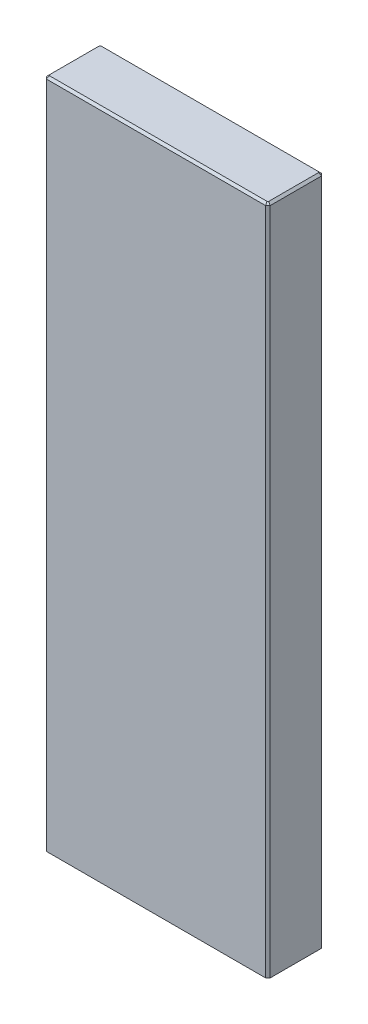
SolidWorks part; units mm, degrees
ref_plane "Front" through (0, 0, 0) normal (0, 0, 1) x (1, 0, 0)
ref_plane "Top" through (0, 0, 0) normal (0, 1, 0) x (1, 0, 0)
ref_plane "Right" through (0, 0, 0) normal (1, 0, 0) x (0, 0, -1)
sketch "Sketch1" plane through (0, 0, 0) normal (0, 0, 1) x (1, 0, 0)
  line L1 (-25.4, 152.4) -> (25.4, 152.4)
  line L2 (-25.4, 152.4) -> (-25.4, 0)
  line L3 (-25.4, 0) -> (25.4, 0)
  line L4 (25.4, 152.4) -> (25.4, 0)
  dimension "D1" = 152.4
  dimension "D2" = 50.8
extrude "Extrude1" add sketch "Sketch1" along normal blind 12.7
hole_wizard "#10-32 Tapped Hole1" positions "3DSketch1" profile "Sketch2" tap size "#10-32" standard "Ansi Inch"
sketch3d "3DSketch1"
  line L0 (25.4, 0, 6.35) -> (14.0875, 0, 6.35) construction
  line L1 (25.4, 0, 12.7) -> (25.4, 0, 0) construction
  point P0 (14.0875, 0, 6.35)
  dimension "D1" = 11.3125
sketch "Sketch2" plane through (14.0875, 0, 6.35) normal (1, 0, 0) x (0, 0, -1)
  line L0 (0, 0) -> (0, 28.9933)
  line L1 (0, 28.9933) -> (2.0193, 27.78)
  line L2 (2.0193, 27.78) -> (2.0193, 25.4)
  line L3 (2.0193, 25.4) -> (2.413, 25.4)
  line L5 (2.413, 25.4) -> (2.413, 0.635)
  line L6 (2.413, 0.635) -> (3.048, 0)
  line L7 (3.048, 0) -> (0, 0)
  line L8 (-2.413, 0.635) -> (-3.048, 0) construction
  line L10 (0, 28.9933) -> (-2.0193, 27.78) construction
  line L11 (0, -6.35) -> (0, 107.95) construction
  dimension "Tap Drill Dia." = 4.0386
  dimension "Tap Drill Depth" = 27.78
  dimension "Thread Major Dia." = 4.826
  dimension "Thread Depth" = 25.4
  dimension "Near C'Sink Dia." = 6.096
  dimension "Near C'Sink Angle" = 90
  dimension "Drill Angle" = 118
chamfer "Chamfer1" distance 0.5 angle 45 4 edges at (25.4, 76.2, 0) (25.4, 76.2, 12.7) (-25.4, 76.2, 0) (-25.4, 76.2, 12.7)
chamfer "Chamfer2" distance 0.5 angle 45 8 edges at (25.15, 152.4, 12.45) (0, 152.4, 12.7) (-25.15, 152.4, 12.45) (-25.4, 152.4, 6.35) (-25.15, 152.4, 0.25) (0, 152.4, 0) (25.15, 152.4, 0.25) (25.4, 152.4, 6.35)
